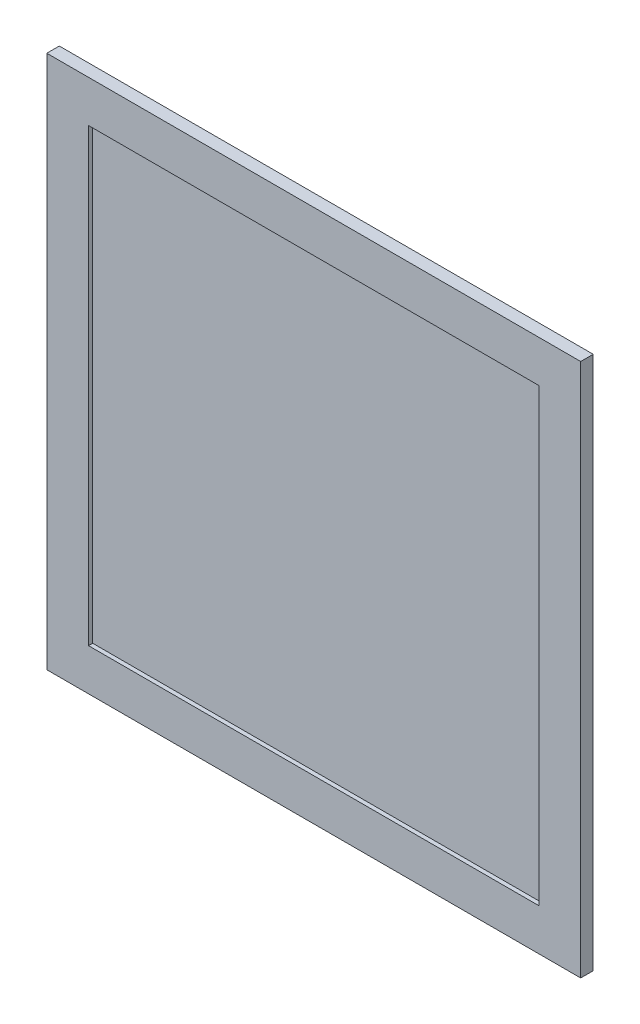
SolidWorks part; units mm, degrees
ref_plane "Front" through (0, 0, 0) normal (0, 0, 1) x (1, 0, 0)
ref_plane "Top" through (0, 0, 0) normal (0, 1, 0) x (1, 0, 0)
ref_plane "Right" through (0, 0, 0) normal (1, 0, 0) x (0, 0, -1)
sketch "Sketch1" plane through (0, 0, 0) normal (0, 0, 1) x (1, 0, 0)
  line L1 (64, -64) -> (-64, -64)
  line L2 (64, -64) -> (64, 64)
  line L3 (64, 64) -> (-64, 64)
  line L4 (-64, -64) -> (-64, 64)
  line L5 (64, -64) -> (-64, 64) construction
  line L6 (64, 64) -> (-64, -64) construction
  point P0 (0, 0)
  dimension "D1" = 128
extrude "Extrude1" add sketch "Sketch1" along normal mid plane 1
sketch "Sketch2" plane through (0, 0, 0) normal (0, 0, 1) x (1, 0, 0)
  line L8 (-54, 54) -> (-54, -54)
  line L9 (-54, -54) -> (54, -54)
  line L10 (54, -54) -> (54, 54)
  line L11 (54, 54) -> (-54, 54)
  line L12 (-54, 54) -> (-54, -54)
  line L13 (-54, -54) -> (54, -54)
  line L14 (54, -54) -> (54, 54)
  line L15 (54, 54) -> (-54, 54)
  line L16 (-64, 64) -> (-64, -64)
  line L17 (-64, -64) -> (64, -64)
  line L18 (64, -64) -> (64, 64)
  line L19 (64, 64) -> (-64, 64)
  line L20 (-64, 64) -> (-64, -64)
  line L21 (-64, -64) -> (64, -64)
  line L22 (64, -64) -> (64, 64)
  line L23 (64, 64) -> (-64, 64)
  dimension "D1" = 10
  dimension "D2" = 0
extrude "Extrude2" add sketch "Sketch2" along normal mid plane 3
